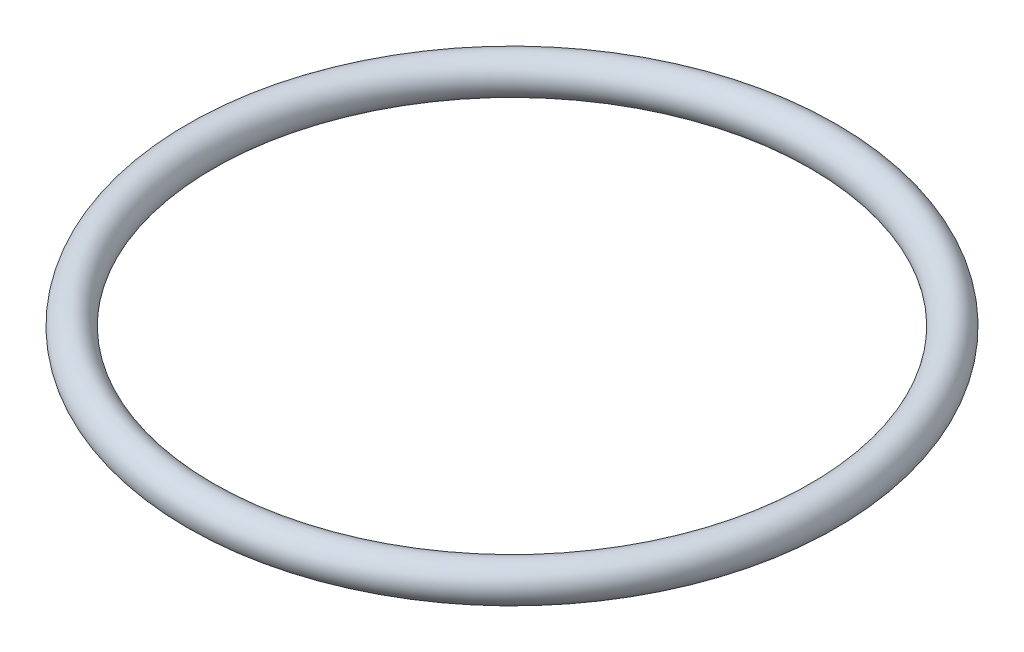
SolidWorks part; units mm, degrees
ref_plane "Plan de face" through (0, 0, 0) normal (0, 0, 1) x (1, 0, 0)
ref_plane "Plan de dessus" through (0, 0, 0) normal (0, 1, 0) x (1, 0, 0)
ref_plane "Plan de droite" through (0, 0, 0) normal (1, 0, 0) x (0, 0, -1)
sketch "Esquisse1" plane through (0, 0, 0) normal (0, 0, 1) x (1, 0, 0)
  line L0 (0, 0) -> (0, 24.5765) construction
  line L1 (0, 0) -> (15, 0) construction
  circle A0 centre (15, 0) radius 0.875
  dimension "D1" = 1.75
  dimension "D2" = 30
revolve "Révolution1" add sketch "Esquisse1" angle 360 about L0
